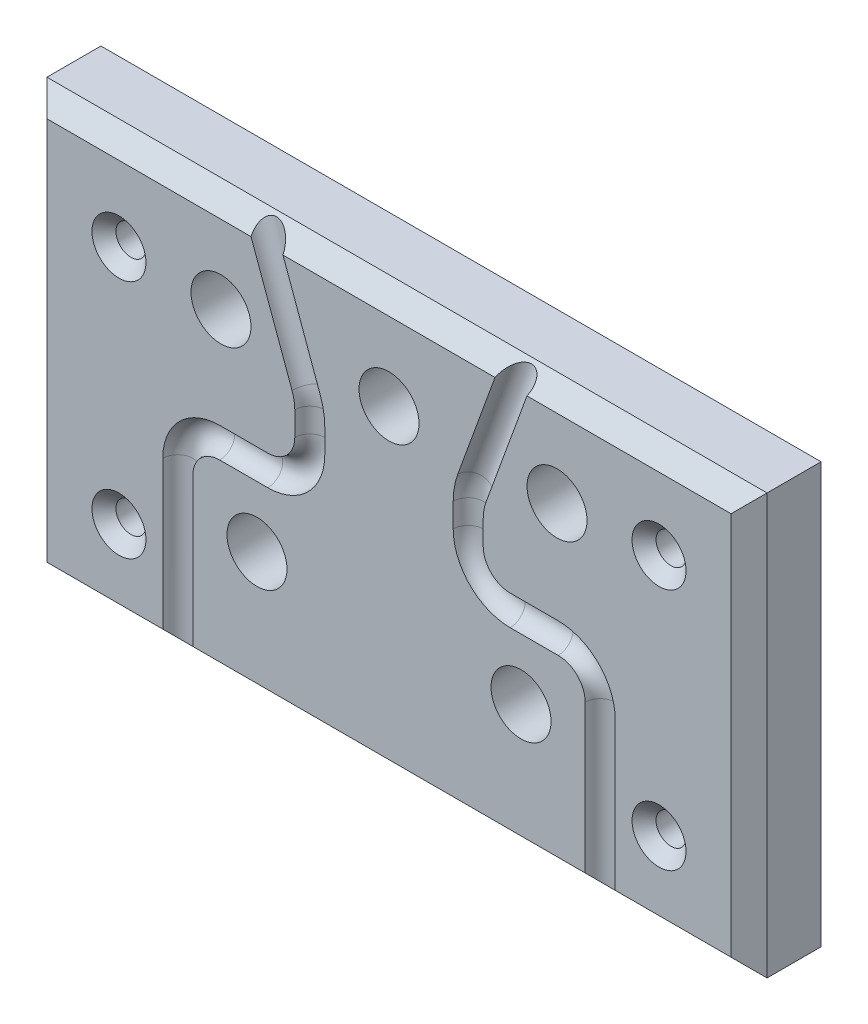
SolidWorks part; units mm, degrees
ref_plane "Face" through (0, 0, 0) normal (0, 0, 1) x (1, 0, 0)
ref_plane "Dessus" through (0, 0, 0) normal (0, 1, 0) x (1, 0, 0)
ref_plane "Droite" through (0, 0, 0) normal (1, 0, 0) x (0, 0, -1)
sketch "Esquisse1" plane through (0, 0, 0) normal (0, 0, 1) x (1, 0, 0)
  line L1 (-60, 52.9284) -> (60, 52.9284)
  line L2 (-60, 52.9284) -> (-60, -17.0716)
  line L3 (-60, -17.0716) -> (60, -17.0716)
  line L4 (60, 52.9284) -> (60, -17.0716)
  dimension "D1" = 120
  dimension "D2" = 70
  dimension "D3" = 60
extrude "Base-Extrusion" add sketch "Esquisse1" along normal blind 12
chamfer "Chanfrein1" distance 3 angle 45 4 edges at (60, 17.9284, 12) (0, 52.9284, 12) (-60, 17.9284, 12) (0, -17.0716, 12)
hole_wizard "Fraisage pour vis à tête fraisée M21" positions "Esquisse5" profile "Esquisse4" countersink size "M2" standard "ISO"
sketch "Esquisse5" plane through (0, 0, 12) normal (0, 0, 1) x (1, 0, 0)
  line L0 (60, -17.0716) -> (-60, -17.0716) construction
  line L1 (-60, -17.0716) -> (-60, 52.9284) construction
  line L2 (60, 52.9284) -> (60, -17.0716) construction
  line L3 (-60, 52.9284) -> (60, 52.9284) construction
  point P0 (-45, 37.4284)
  point P1 (45, 37.9284)
  point P2 (45, -2.5716)
  point P3 (-45, -2.5716)
  dimension "D1" = 15
  dimension "D2" = 40
  dimension "D4" = 14.5
  dimension "D5" = 15
  dimension "D6" = 15
  dimension "D7" = 15
  dimension "D8" = 15
sketch "Esquisse4" plane through (-45, 37.4284, 12) normal (1, 0, 0) x (0, -1, 0)
  line L0 (0, 0) -> (0, 12)
  line L1 (0, 12) -> (2.5, 12)
  line L2 (2.5, 12) -> (2.5, 2)
  line L3 (2.5, 2) -> (4.5, 0)
  line L5 (4.5, 0) -> (0, 0)
  line L6 (-2.5, 2) -> (-4.5, 0) construction
  line L11 (0, -6.35) -> (0, 107.95) construction
  dimension "Diamètre du perçage jusqu'au prochain" = 5
  dimension "Profondeur du perçage jusqu'au prochain" = 12
  dimension "Diamètre du fraisage entrant" = 9
  dimension "Angle du fraisage entrant" = 90
sketch "Esquisse17" plane through (0, -17.0716, 0) normal (0, -1, 0) x (1, 0, 0)
  line L0 (-57, 12) -> (57, 12) construction
  line L1 (0, -6.6) -> (0, 6.6) construction
  circle A0 centre (35.2, 12) radius 2.5
  dimension "D1" = 5
  dimension "D2" = 35.2
extrude "Enlèv. mat.-Extru.4" cut sketch "Esquisse17" against normal blind 27.65
sketch "Esquisse18" plane through (0, 10.5784, 0) normal (0, -1, 0) x (1, 0, 0)
  line L0 (32.7, 12) -> (37.7, 12) construction
  line L1 (28.2, 17.5691) -> (28.2, 4.4718) construction
  circle A0 centre (35.2, 12) radius 2.5
  dimension "D1" = 5
  dimension "D2" = 7
revolve "Enlèvement de matière-Révolution2" cut sketch "Esquisse18" angle 90 about L1
sketch "Esquisse19" plane through (28.2, 0, 0) normal (1, 0, 0) x (0, 0, -1)
  line L0 (-12, 15.0784) -> (-12, 20.0784) construction
  circle A0 centre (-12, 17.5784) radius 2.5
  point P0 (-12, 17.5784)
extrude "Enlèv. mat.-Extru.5" cut sketch "Esquisse19" against normal blind 8
sketch "Esquisse20" plane through (20.2, 0, 0) normal (1, 0, 0) x (0, 0, -1)
  line L0 (-15.8678, 24.5784) -> (-8.452, 24.5784) construction
  circle A0 centre (-12, 17.5784) radius 2.5
  dimension "D1" = 5
  dimension "D2" = 7
revolve "Enlèvement de matière-Révolution3" cut sketch "Esquisse20" angle 90 about L0
sketch "Esquisse21" plane through (0, 24.5784, 0) normal (0, -1, 0) x (1, 0, 0)
  line L2 (20.2, 12) -> (28.2, 12) construction
  circle A0 centre (13.2, 12) radius 2.5
  point P1 (13.2, 12)
  dimension "D1" = 2.5
extrude "Enlèv. mat.-Extru.6" cut sketch "Esquisse21" against normal blind 4
sketch "Esquisse22" plane through (0, 28.5784, 0) normal (0, -1, 0) x (1, 0, 0)
  line L0 (23.2, 17.957) -> (23.2, 6.8391) construction
  circle A0 centre (13.2, 12) radius 2.5
  point P0 (13.2, 12)
  dimension "D1" = 5
  dimension "D2" = 10
revolve "Enlèvement de matière-Révolution4" cut sketch "Esquisse22" angle 20 about L0
sketch "Esquisse23" plane through (11.8988, 32.6917, 0) normal (-0.342, -0.9397, 0) x (0.9397, -0.342, 0)
  line L0 (-0.4735, 12) -> (4.5265, 12) construction
  circle A0 centre (2.0265, 12) radius 2.5
  point P0 (2.0265, 12)
extrude "Enlèv. mat.-Extru.7" cut sketch "Esquisse23" against normal through all
mirror "Symétrie1" about plane through (0, 0, 0) normal (1, 0, 0) of "Enlèvement de matière-Révolution4", "Enlèv. mat.-Extru.6", "Enlèvement de matière-Révolution3", "Enlèv. mat.-Extru.5", "Enlèvement de matière-Révolution2", "Enlèv. mat.-Extru.4", "Enlèv. mat.-Extru.7"
sketch "Esquisse24" plane through (0, 0, 12) normal (0, 0, 1) x (1, 0, 0)
  line L0 (0, -6.6) -> (0, 6.6) construction
  line L1 (60, -17.0716) -> (-60, -17.0716) construction
  line L2 (-60, 52.9284) -> (60, 52.9284) construction
  line L3 (-60, 52.9284) -> (60, 52.9284) construction
  line L4 (-60, 52.9284) -> (60, 52.9284) construction
  circle A0 centre (-28, 36.9284) radius 5
  circle A1 centre (28, 36.9284) radius 5
  circle A2 centre (-22, 4.9284) radius 5
  circle A3 centre (22, 4.9284) radius 5
  circle A4 centre (0, 36.9284) radius 5
  dimension "D1" = 10
  dimension "D2" = 10
  dimension "D5" = 10
  dimension "D6" = 10
  dimension "D10" = 22
  dimension "D13" = 10
  dimension "D14" = 16
  dimension "D3" = 28
  dimension "D4" = 28
  dimension "D7" = 22
  dimension "D8" = 22
  dimension "D9" = 22
  dimension "D11" = 16
  dimension "D12" = 16
extrude "Enlèv. mat.-Extru.8" cut sketch "Esquisse24" against normal blind 18
sketch "Esquisse25" plane through (60, 0, 0) normal (1, 0, 0) x (0, 0, -1)
  line L0 (-7, -17.0716) -> (0, -10.0716)
  line L1 (-9, -17.0716) -> (0, -17.0716) construction
  line L2 (0, -17.0716) -> (0, 52.9284) construction
  line L3 (0, -10.0716) -> (0, -17.0716)
  line L4 (0, -17.0716) -> (-7, -17.0716)
  dimension "D1" = 7
  dimension "D2" = 7
